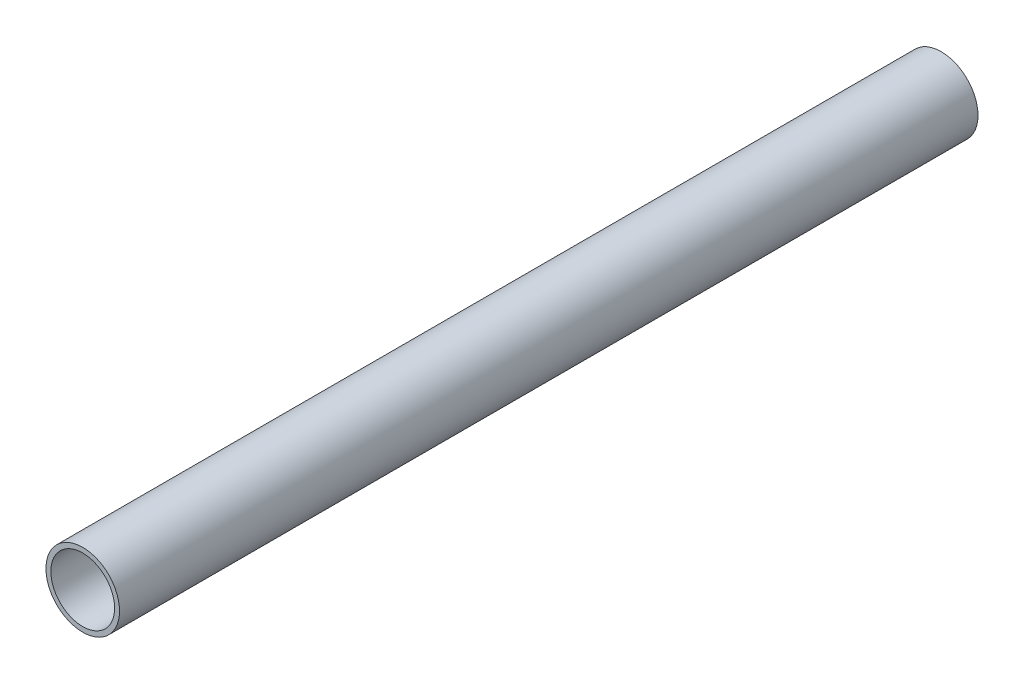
SolidWorks part; units mm, degrees
ref_plane "Plan de face" through (0, 0, 0) normal (0, 0, 1) x (1, 0, 0)
ref_plane "Plan de dessus" through (0, 0, 0) normal (0, 1, 0) x (1, 0, 0)
ref_plane "Plan de droite" through (0, 0, 0) normal (1, 0, 0) x (0, 0, -1)
sketch "Esquisse1" plane through (0, 0, 0) normal (0, 0, 1) x (1, 0, 0)
  circle A0 centre (0, 0) radius 30
  circle A1 centre (0, 0) radius 25
  dimension "D1" = 60
  dimension "D2" = 50
extrude "Extrusion1" add sketch "Esquisse1" along normal blind 700
sketch "Esquisse2" plane through (0, 0, 0) normal (0, 0, -1) x (-1, 0, 0)
  circle A0 centre (0, 0) radius 26
  circle A1 centre (0, 0) radius 25 construction
  circle A2 centre (0, 0) radius 25
  dimension "D1" = 52
extrude "Enlèv. mat.-Extru.1" cut sketch "Esquisse2" against normal blind 70
sketch "Esquisse3" plane through (0, 0, 700) normal (0, 0, 1) x (1, 0, 0)
  circle A0 centre (0, 0) radius 26
  circle A1 centre (0, 0) radius 25 construction
  circle A2 centre (0, 0) radius 25
  dimension "D1" = 52
extrude "Enlèv. mat.-Extru.2" cut sketch "Esquisse3" against normal blind 70
